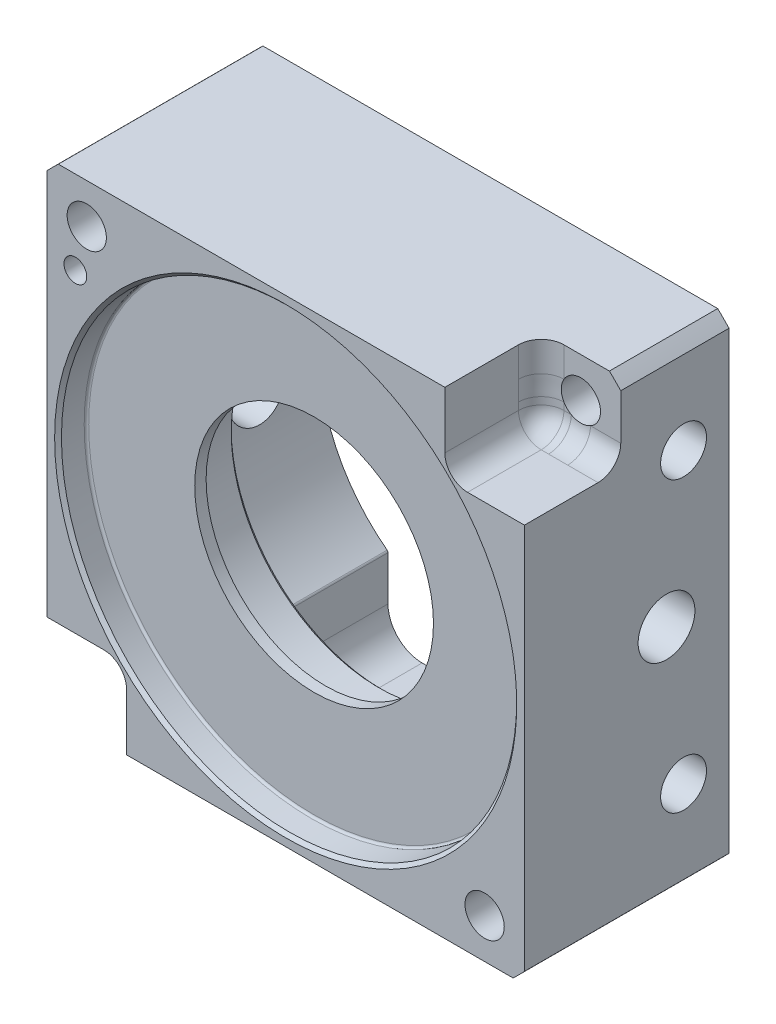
SolidWorks part; units mm, degrees
other "<217-2625-001 Rev1>-<Imported1>"
ref_plane "Front Plane" through (0, 0, 0) normal (0, 0, 1) x (1, 0, 0)
ref_plane "Top Plane" through (0, 0, 0) normal (0, 1, 0) x (1, 0, 0)
ref_plane "Right Plane" through (0, 0, 0) normal (1, 0, 0) x (0, 0, -1)
mirrored part "217-2625-001 Rev1_Mirrored"
